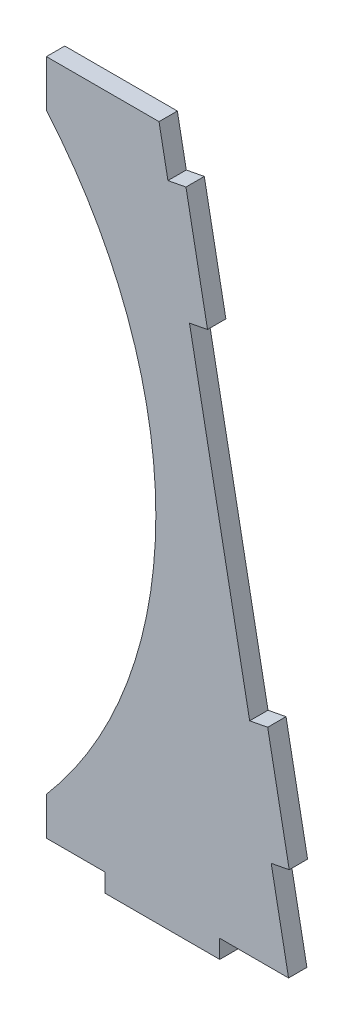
SolidWorks part; units mm, degrees
ref_plane "Front Plane" through (0, 0, 0) normal (0, 0, 1) x (1, 0, 0)
ref_plane "Top Plane" through (0, 0, 0) normal (0, 1, 0) x (1, 0, 0)
ref_plane "Right Plane" through (0, 0, 0) normal (1, 0, 0) x (0, 0, -1)
sketch "Sketch1" plane through (0, 0, 0) normal (0, 0, 1) x (1, 0, 0)
  line L0 (33.4437, 1.143) -> (33.4437, -0.381)
  line L1 (33.4437, -0.381) -> (42.9687, -0.381)
  line L2 (42.9687, -0.381) -> (42.9687, 1.143)
  line L3 (42.9687, 1.143) -> (48.6841, 1.143)
  line L4 (48.6841, 1.143) -> (47.2435, 8.6706)
  line L5 (38.6665, 53.4893) -> (37.9255, 57.361)
  line L6 (45.4532, 18.0258) -> (40.4568, 44.1341)
  line L7 (40.4568, 44.1341) -> (41.9536, 44.4205)
  line L8 (47.2435, 8.6706) -> (48.7404, 8.957)
  line L9 (38.6665, 53.4893) -> (40.1633, 53.7758)
  line L10 (45.4532, 18.0258) -> (46.95, 18.3123)
  line L11 (37.9255, 57.361) -> (28.5737, 57.361)
  line L12 (41.9536, 44.4205) -> (40.1633, 53.7758)
  line L13 (28.5737, 57.361) -> (28.5737, 53.4893)
  line L14 (48.7404, 8.957) -> (46.95, 18.3123)
  line L15 (28.5737, 1.143) -> (33.4437, 1.143)
  line L16 (28.5737, 4.3054) -> (28.5737, 1.143)
  arc A0 (28.5737, 4.3054) -> (28.5737, 53.4893) centre (-0.1532, 28.8974) ccw
extrude "Boss-Extrude1" add sketch "Sketch1" along normal blind 1.524
